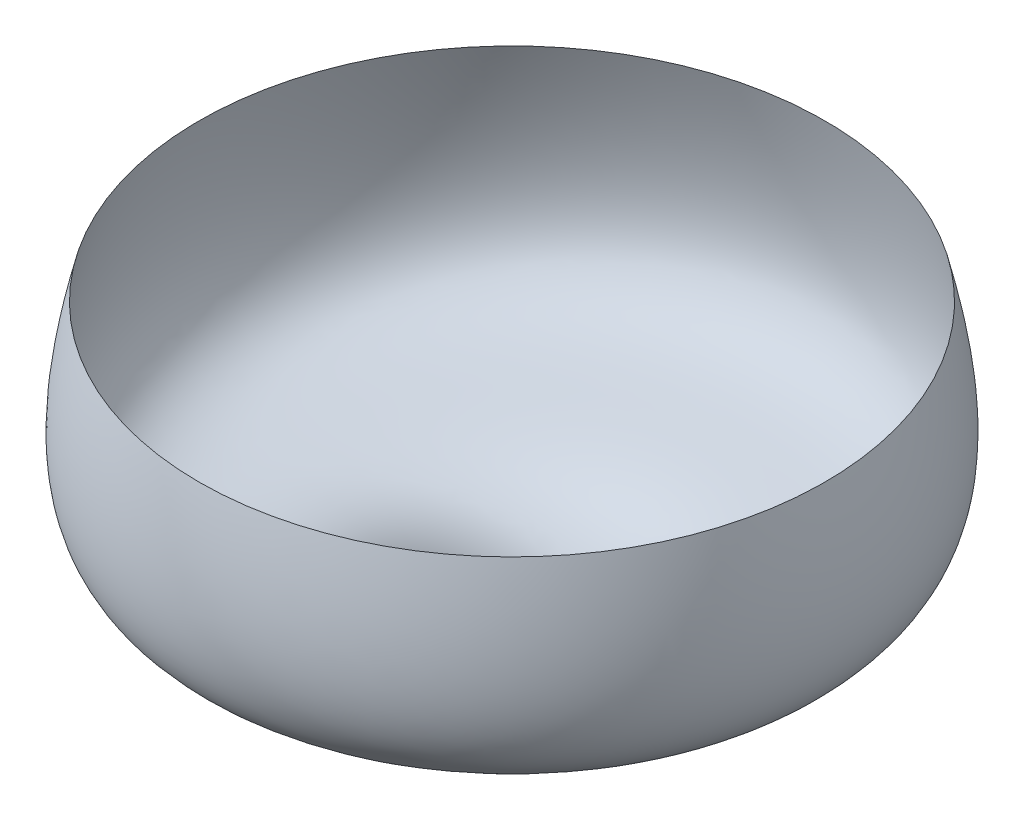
SolidWorks part; units mm, degrees
ref_plane "Front Plane" through (0, 0, 0) normal (0, 0, 1) x (1, 0, 0)
ref_plane "Top Plane" through (0, 0, 0) normal (0, 1, 0) x (1, 0, 0)
ref_plane "Right Plane" through (0, 0, 0) normal (1, 0, 0) x (0, 0, -1)
sketch "Sketch1" plane through (0, 0, 0) normal (0, 0, 1) x (1, 0, 0)
  line L0 (0, 0) -> (0, 66.0872) construction
  spline S0 degree 3 poles (156.6512, 87.5724) (199.5854, -87.1667) (63.27, 21.5759) (40.5779, -66.6765) knots 0 0 0 0 1 1 1 1
surface "Surface-Revolve1" sketch "Sketch1" parameters "D1"=360
